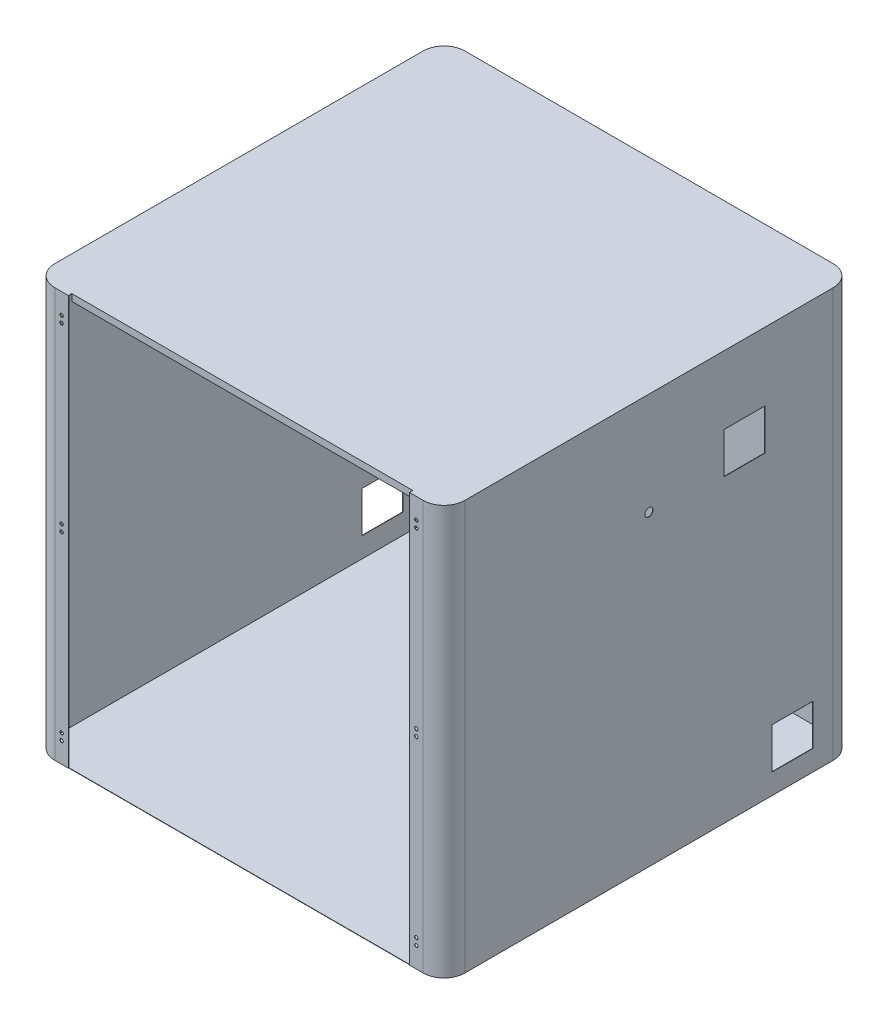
SolidWorks part; units mm, degrees
ref_plane "Alzado" through (0, 0, 0) normal (0, 0, 1) x (1, 0, 0)
ref_plane "Planta" through (0, 0, 0) normal (0, 1, 0) x (1, 0, 0)
ref_plane "Vista lateral" through (0, 0, 0) normal (1, 0, 0) x (0, 0, -1)
sketch "Sketch1" plane through (0, 0, 0) normal (0, 1, 0) x (1, 0, 0)
  line L1 (-270, -300) -> (270, -300)
  line L2 (-300, -270) -> (-300, 270)
  line L3 (-270, 300) -> (270, 300)
  line L4 (300, -270) -> (300, 270)
  line L5 (-300, -300) -> (300, 300) construction
  line L6 (-300, 300) -> (300, -300) construction
  arc A0 (-270, -300) -> (-300, -270) centre (-270, -270) cw
  arc A1 (270, -300) -> (300, -270) centre (270, -270) ccw
  arc A2 (270, 300) -> (300, 270) centre (270, 270) cw
  arc A3 (-300, 270) -> (-270, 300) centre (-270, 270) cw
  point P0 (0, 0)
  dimension "D3" = 30
  dimension "D1" = 600
  dimension "D2" = 600
extrude "Extrude-Thin1" add sketch "Sketch1" along normal blind 600 thin
sketch "Sketch2" plane through (0, 0, 300.5) normal (0, 0, 1) x (1, 0, 0)
  line L0 (0, 0) -> (0, 300) construction
  line L2 (300.5, 600) -> (300.5, 0) construction
  line L3 (300.5, 300) -> (0, 300) construction
  line L4 (-270, 600) -> (270, 600) construction
  line L5 (-250, 0) -> (250, 0)
  line L6 (-250, 0) -> (-250, 600)
  line L7 (-250, 600) -> (250, 600)
  line L8 (250, 0) -> (250, 600)
  line L9 (-250, 0) -> (250, 600) construction
  line L10 (-250, 600) -> (250, 0) construction
  dimension "D1" = 500
extrude "Cut-Extrude1" cut sketch "Sketch2" against normal blind 10
sketch "Sketch3" plane through (0, 600, 0) normal (0, 1, 0) x (1, 0, 0)
  line L1 (270, 300) -> (-270, 300) construction
  line L2 (-300, 270) -> (-300, -270) construction
  line L3 (300, -270) -> (300, 270) construction
  line L4 (270, 300) -> (-270, 300)
  line L5 (-300, 270) -> (-300, -270)
  line L6 (-270, -300) -> (270, -300)
  line L7 (300, -270) -> (300, 270)
  arc A0 (270, -300) -> (300, -270) centre (270, -270) ccw construction
  arc A2 (300, 270) -> (270, 300) centre (270, 270) ccw construction
  arc A3 (-270, 300) -> (-300, 270) centre (-270, 270) ccw construction
  arc A4 (270, -300) -> (300, -270) centre (270, -270) ccw
  arc A5 (-300, -270) -> (-270, -300) centre (-270, -270) ccw construction
  arc A6 (300, 270) -> (270, 300) centre (270, 270) ccw
  arc A7 (-270, 300) -> (-300, 270) centre (-270, 270) ccw
  arc A8 (-300, -270) -> (-270, -300) centre (-270, -270) ccw
extrude "Boss-Extrude1" add sketch "Sketch3" against normal blind 0.5
ref_plane "Plane1" through (0, 300, 0) normal (0, 1, 0) x (1, 0, 0)
mirror "Mirror1" about plane through (0, 300, 0) normal (0, 1, 0) of "Boss-Extrude1"
sketch "Sketch5" plane through (300.5, 0, 0) normal (1, 0, 0) x (0, 0, -1)
  line L0 (170, 500) -> (270, 500) construction
  line L1 (110, 440) -> (170, 440)
  line L2 (110, 440) -> (110, 500)
  line L3 (110, 500) -> (170, 500)
  line L4 (170, 440) -> (170, 500)
  line L5 (110, 440) -> (170, 500) construction
  line L6 (110, 500) -> (170, 440) construction
  line L7 (270, 600) -> (270, 0) construction
  line L8 (270, 500) -> (270, 600) construction
  point P0 (140, 470)
  dimension "D1" = 60
  dimension "D2" = 100
  dimension "D3" = 100
extrude "Cut-Extrude2" cut sketch "Sketch5" against normal blind 0.5
sketch "Sketch6" plane through (-300.5, 0, 0) normal (-1, 0, 0) x (0, 0, 1)
  line L0 (-270, 600) -> (-270, 0) construction
  line L1 (-240, 30) -> (-180, 30)
  line L2 (-240, 30) -> (-240, 90)
  line L3 (-240, 90) -> (-180, 90)
  line L4 (-180, 30) -> (-180, 90)
  line L5 (-240, 30) -> (-180, 90) construction
  line L6 (-240, 90) -> (-180, 30) construction
  line L7 (-270, 0) -> (270, 0) construction
  line L8 (0, 0) -> (0, 99.0919) construction
  point P0 (-210, 60)
  dimension "D1" = 60
  dimension "D2" = 30
  dimension "D3" = 30
extrude "Cut-Extrude4" cut sketch "Sketch6" against normal blind 794.5
sketch "Sketch7" plane through (300.5, 0, 0) normal (1, 0, 0) x (0, 0, -1)
  line L0 (0, 0) -> (0, 450) construction
  circle A0 centre (0, 450) radius 6
  dimension "D2" = 12
  dimension "D1" = 450
sketch "Sketch8" plane through (0, 600, 0) normal (0, 1, 0) x (1, 0, 0)
  line L0 (-250, -300.5) -> (-250, -295.5)
  line L1 (-250, -295.5) -> (250, -295.5)
  line L2 (250, -295.5) -> (250, -300.5)
  line L3 (-250, -300.5) -> (250, -300.5)
  dimension "D1" = 5
extrude "Cut-Extrude5" cut sketch "Sketch8" against normal blind 78
sketch "Sketch9" plane through (0, 0, 295.5) normal (0, 0, 1) x (1, 0, 0)
  line L0 (-250, 600) -> (-250, 590)
  line L2 (-250, 590) -> (250, 590)
  line L4 (250, 590) -> (250, 600)
  line L5 (250, 600) -> (-250, 600)
  line L6 (-250, 600) -> (-250, 0) construction
  line L7 (250, 0) -> (250, 600) construction
  line L8 (-270, 600) -> (-250, 600) construction
  dimension "D1" = 10
extrude "Boss-Extrude6" add sketch "Sketch9" against normal blind 0.5
sketch "Sketch11" plane through (0, 0, 300.5) normal (0, 0, 1) x (1, 0, 0)
  line L0 (-250, 0) -> (-260, 0) construction
  line L1 (-270, 0) -> (-250, 0) construction
  line L2 (-260, 0) -> (-260, 30) construction
  line L3 (-260, 30) -> (-260, 40) construction
  line L4 (-260, 35) -> (-260, 300) construction
  line L5 (330.55, 300) -> (-330.55, 300) construction
  line L6 (-260, 167.5) -> (-227.2265, 167.5) construction
  line L7 (-260, 300) -> (-250, 300) construction
  line L8 (0, 0.5) -> (0, 344.4156) construction
  line L9 (270, 0.5) -> (-270, 0.5) construction
  line L10 (260, 300) -> (250, 300) construction
  line L11 (260, 167.5) -> (227.2265, 167.5) construction
  line L12 (260, 35) -> (260, 300) construction
  line L13 (260, 30) -> (260, 40) construction
  line L14 (260, 0) -> (260, 30) construction
  line L15 (250, 0) -> (260, 0) construction
  circle A0 centre (-260, 30) radius 2.5
  circle A1 centre (-260, 40) radius 2.5
  circle A2 centre (-260, 295) radius 2.5
  circle A3 centre (-260, 305) radius 2.5
  circle A4 centre (-260, 570) radius 2.5
  circle A5 centre (-260, 560) radius 2.5
  circle A6 centre (260, 560) radius 2.5
  circle A7 centre (260, 570) radius 2.5
  circle A8 centre (260, 305) radius 2.5
  circle A9 centre (260, 295) radius 2.5
  circle A10 centre (260, 40) radius 2.5
  circle A11 centre (260, 30) radius 2.5
  dimension "D4" = 5
  dimension "D1" = 10
  dimension "D2" = 30
  dimension "D3" = 10
extrude "Cut-Extrude6" cut sketch "Sketch11" against normal blind 0.5
extrude "Cut-Extrude7" cut sketch "Sketch7" against normal blind 10
